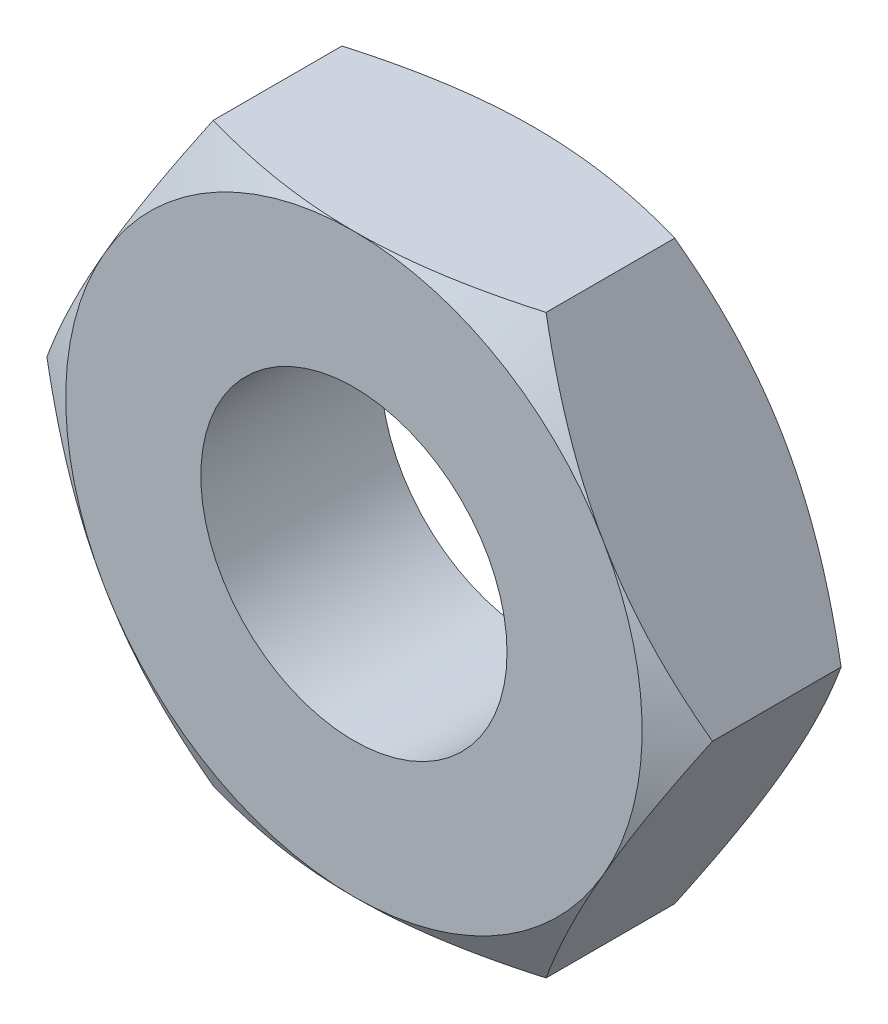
SolidWorks part; units mm, degrees
ref_plane "Front Plane" through (0, 0, 0) normal (0, 0, 1) x (1, 0, 0)
ref_plane "Top Plane" through (0, 0, 0) normal (0, 1, 0) x (1, 0, 0)
ref_plane "Right Plane" through (0, 0, 0) normal (1, 0, 0) x (0, 0, -1)
sketch "Sketch1" plane through (0, 0, 0) normal (0, 0, 1) x (1, 0, 0)
  line L1 (4.6188, 8) -> (-4.6188, 8)
  line L2 (-4.6188, 8) -> (-9.2376, 0)
  line L3 (-9.2376, 0) -> (-4.6188, -8)
  line L4 (-4.6188, -8) -> (4.6188, -8)
  line L5 (4.6188, -8) -> (9.2376, 0)
  line L6 (9.2376, 0) -> (4.6188, 8)
  circle A0 centre (0, 0) radius 8 construction
  dimension "D1" = 16
extrude "Extrude1" add sketch "Sketch1" along normal mid plane 5
sketch "Sketch2" plane through (0, 0, 0) normal (1, 0, 0) x (0, 0, -1)
  line L0 (-2.5, 8) -> (-2.5, 16)
  line L1 (-2.5, 16) -> (2.1188, 16)
  line L2 (2.1188, 16) -> (-2.5, 8)
  line L3 (0, 0) -> (6.7182, 0) construction
  dimension "D1" = 30
  dimension "D2" = 16
revolve "Cut-Revolve1" cut sketch "Sketch2" angle 360 about L3
mirror "Mirror1" about plane through (0, 0, 0) normal (0, 0, 1) of "Cut-Revolve1"
hole_wizard " Tapped Hole1" positions "Sketch4" profile "Sketch3" tap size "M10" standard "DIN"
sketch "Sketch4" plane through (0, 0, 2.5) normal (0, 0, 1) x (1, 0, 0)
  point P0 (0, 0)
sketch "Sketch3" plane through (0, 0, 2.5) normal (1, 0, 0) x (0, -1, 0)
  line L0 (0, 0) -> (0, 5)
  line L1 (0, 5) -> (4.25, 5)
  line L2 (4.25, 5) -> (4.25, 0)
  line L5 (4.25, 0) -> (0, 0)
  line L11 (0, -6.35) -> (0, 107.95) construction
  dimension "Thru Tap Drill Dia." = 8.5
  dimension "Thru Tap Drill Depth" = 5
